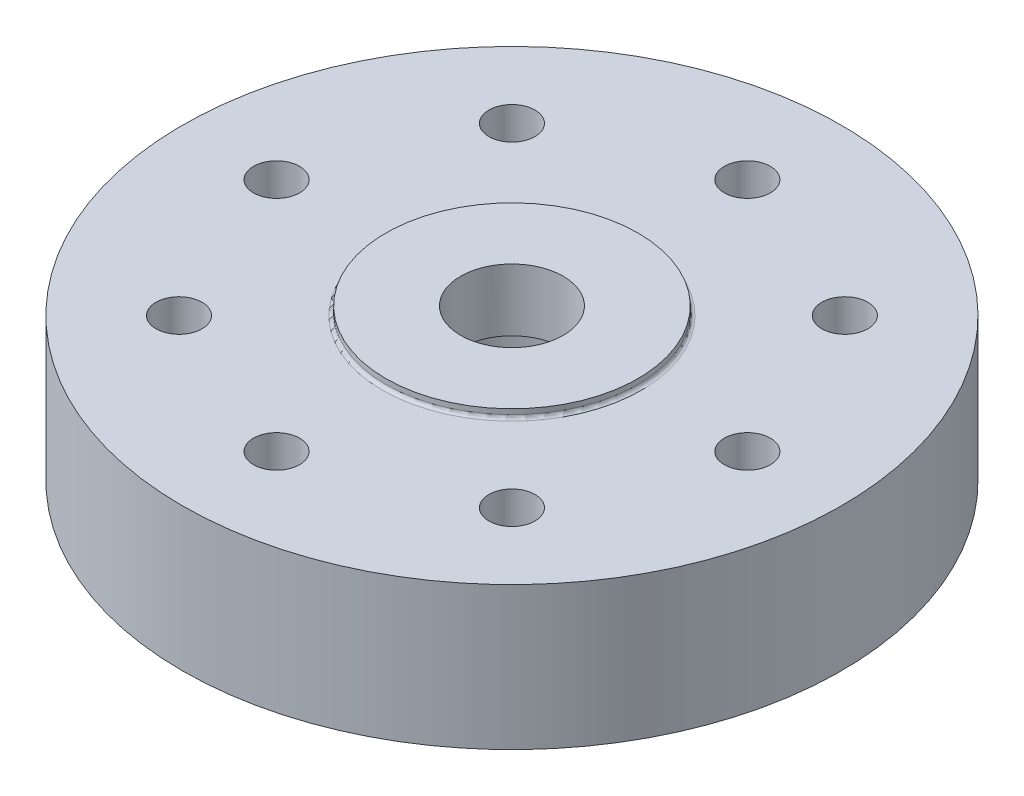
SolidWorks part; units mm, degrees
ref_plane "Front Plane" through (0, 0, 0) normal (0, 0, 1) x (1, 0, 0)
ref_plane "Top Plane" through (0, 0, 0) normal (0, 1, 0) x (1, 0, 0)
ref_plane "Right Plane" through (0, 0, 0) normal (1, 0, 0) x (0, 0, -1)
sketch "Sketch1" plane through (0, 0, 0) normal (0, 1, 0) x (1, 0, 0)
  line L0 (0, 0) -> (0, 7) construction
  line L1 (0, 0) -> (4.9497, 4.9497) construction
  line L2 (0, 0) -> (7, 0) construction
  line L3 (0, 0) -> (4.9497, -4.9497) construction
  line L4 (0, 0) -> (0, -7) construction
  line L5 (0, 0) -> (-4.9497, -4.9497) construction
  line L6 (0, 0) -> (-7, 0) construction
  line L7 (0, 0) -> (-4.9497, 4.9497) construction
  circle A0 centre (0, 0) radius 9.8
  circle A1 centre (0, 7) radius 0.685
  circle A2 centre (4.9497, 4.9497) radius 0.685
  circle A3 centre (7, 0) radius 0.685
  circle A4 centre (4.9497, -4.9497) radius 0.685
  circle A5 centre (0, -7) radius 0.685
  circle A6 centre (-4.9497, -4.9497) radius 0.685
  circle A7 centre (-7, 0) radius 0.685
  circle A8 centre (-4.9497, 4.9497) radius 0.685
  circle A9 centre (0, 0) radius 1.525
  point P21 (0, 0)
  dimension "D1" = 19.6
  dimension "D2" = 7
  dimension "D3" = 1.37
  dimension "D5" = 3.05
  dimension "D4" = 8
extrude "Boss-Extrude1" add sketch "Sketch1" along normal blind 4.25
shell "Shell3" thickness 1.2
sketch "Sketch2" plane through (0, 0, 0) normal (0, -1, 0) x (1, 0, 0)
  circle A0 centre (0, 0) radius 1.525 construction
  circle A1 centre (0, 0) radius 1.525
  circle A2 centre (0, 0) radius 4.4
  dimension "D1" = 8.8
extrude "Boss-Extrude2" add sketch "Sketch2" along normal blind 0.5 and the other way up to surface (4.25 mm away)
sketch "Sketch3" plane through (0, -0.5, 0) normal (0, -1, 0) x (1, 0, 0)
  circle A0 centre (0, 0) radius 2.5
  dimension "D1" = 5
extrude "Cut-Extrude1" cut sketch "Sketch3" against normal blind 3.15
sketch "Sketch4" plane through (0, 4.25, 0) normal (0, 1, 0) x (1, 0, 0)
  circle A0 centre (0, 0) radius 3.75
  circle A1 centre (0, 0) radius 1.525 construction
  circle A2 centre (0, 0) radius 1.525
  dimension "D1" = 7.5
extrude "Boss-Extrude3" add sketch "Sketch4" along normal blind 0.25
fillet "Fillet1" radius 0.1 1 edges at (0, 4.25, 3.75)
